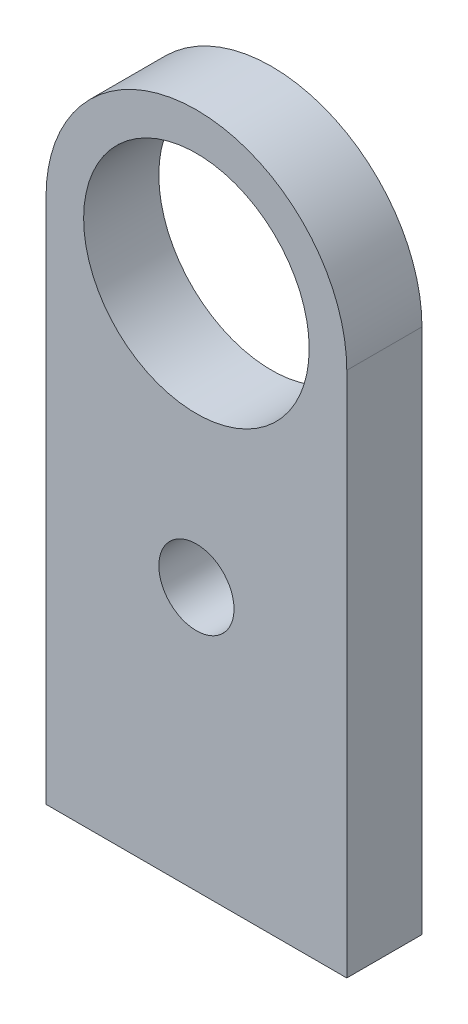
SolidWorks part; units mm, degrees
ref_plane "Front Plane" through (0, 0, 0) normal (0, 0, 1) x (1, 0, 0)
ref_plane "Top Plane" through (0, 0, 0) normal (0, 1, 0) x (1, 0, 0)
ref_plane "Right Plane" through (0, 0, 0) normal (1, 0, 0) x (0, 0, -1)
sketch "Sketch1" plane through (0, 0, 0) normal (0, 0, 1) x (1, 0, 0)
  line L0 (12.7, 0) -> (12.7, -44.45)
  line L1 (12.7, -44.45) -> (-12.7, -44.45)
  line L2 (-12.7, -44.45) -> (-12.7, 0)
  circle A0 centre (0, 0) radius 9.525
  circle A1 centre (0, 0) radius 12.7
  circle A2 centre (0, -22.225) radius 3.175
  dimension "D1" = 19.05
  dimension "D4" = 6.35
  dimension "D2" = 25.4
  dimension "D3" = 44.45
  dimension "D5" = 22.225
  dimension "D6" = 57.15
sketch "Sketch2" plane through (0, 0, 0) normal (0, 0, 1) x (1, 0, 0)
  line L0 (-12.7, -44.45) -> (-12.7, 0) construction
  line L1 (12.7, -44.45) -> (-12.7, -44.45) construction
  line L2 (12.7, 0) -> (12.7, -44.45) construction
  line L3 (-12.7, -44.45) -> (-12.7, 0)
  line L4 (12.7, -44.45) -> (-12.7, -44.45)
  line L5 (12.7, 0) -> (12.7, -44.45)
  circle A0 centre (0, 0) radius 12.7 construction
  circle A1 centre (0, 0) radius 9.525 construction
  arc A2 (12.7, 0) -> (-12.7, 0) centre (0, 0) ccw
  circle A3 centre (0, 0) radius 9.525
  circle A4 centre (0, -22.225) radius 3.175 construction
  circle A5 centre (0, -22.225) radius 3.175
extrude "Boss-Extrude1" add sketch "Sketch2" along normal blind 6.35
